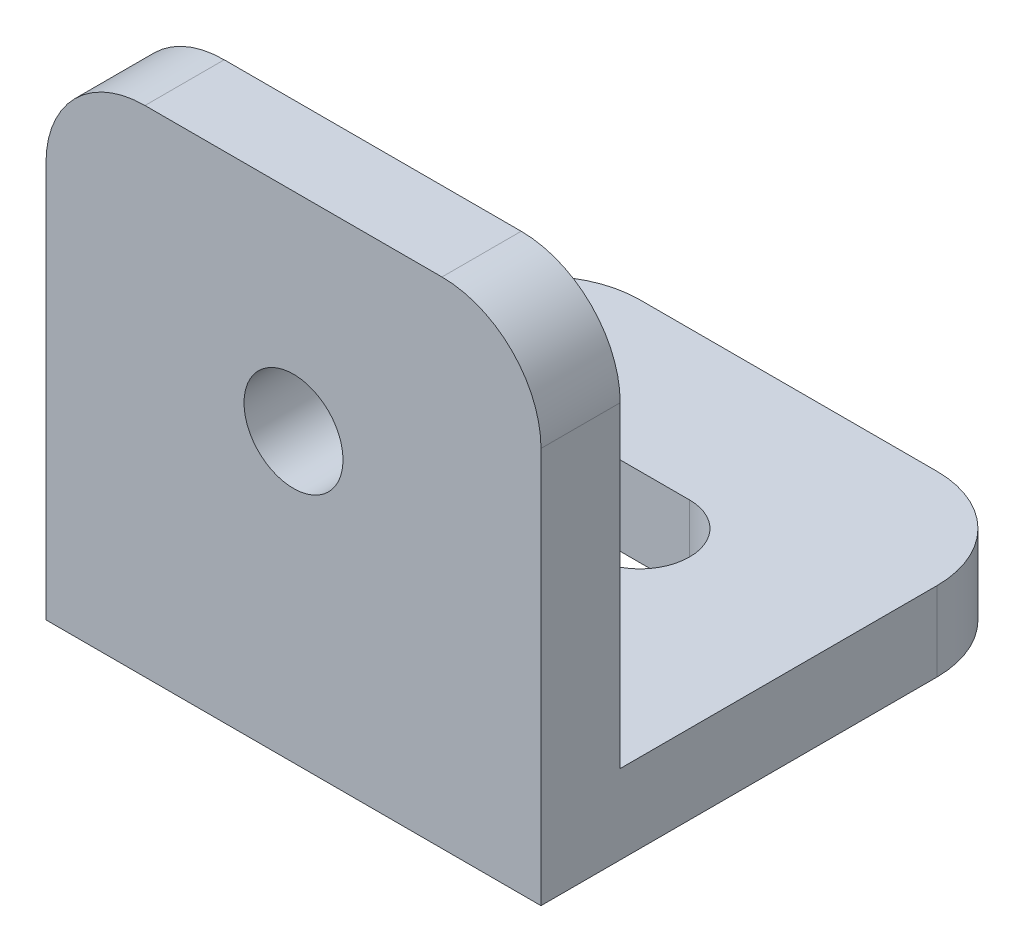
SolidWorks part; units mm, degrees
ref_plane "Front Plane" through (0, 0, 0) normal (0, 0, 1) x (1, 0, 0)
ref_plane "Top Plane" through (0, 0, 0) normal (0, 1, 0) x (1, 0, 0)
ref_plane "Right Plane" through (0, 0, 0) normal (1, 0, 0) x (0, 0, -1)
sketch "Sketch2" plane through (0, 0, 0) normal (1, 0, 0) x (0, 0, -1)
  line L0 (0, 0) -> (50, 0)
  line L2 (0, 50) -> (0, 0)
  dimension "D1" = 50
extrude "Extrude-Thin1" add sketch "Sketch2" along normal mid plane 50 thin
hole_wizard "Ø10.0 (19) Diameter Hole1" positions "Sketch3" profile "Sketch4" hole size "Ø10.0" standard "ANSI Metric"
sketch "Sketch3" plane through (0, 0, -8) normal (0, 0, -1) x (-1, 0, 0)
  line L0 (0, 50) -> (0, 8) construction
  line L1 (-25, 50) -> (25, 50) construction
  line L2 (-25, 8) -> (25, 8) construction
  point P8 (0, 29)
sketch "Sketch4" plane through (0, 29, -8) normal (1, 0, 0) x (0, 1, 0)
  line L0 (0, 0) -> (0, 8)
  line L1 (0, 8) -> (5, 8)
  line L2 (5, 8) -> (5, 0)
  line L5 (5, 0) -> (0, 0)
  line L11 (0, -6.35) -> (0, 107.95) construction
  dimension "Thru Hole Dia." = 10
  dimension "Thru Hole Depth" = 8
hole_wizard "Ø10.0 (10) Diameter Slot1" positions "Sketch5" profile "Sketch7" size "Ø10.0" standard "ANSI Metric"
sketch "Sketch5" plane through (0, 8, 0) normal (0, 1, 0) x (1, 0, 0)
  line L0 (-10, 30) -> (10, 30) construction
  line L1 (0, 30) -> (0, 50) construction
  line L2 (25, 50) -> (-25, 50) construction
  point P0 (0, 30)
  dimension "D1" = 20
  dimension "D2" = 20
sketch "Sketch7" plane through (0, 8, -30) normal (1, 0, 0) x (0, 0, 1)
  line L0 (0, 0) -> (0, 8)
  line L1 (0, 8) -> (5, 8)
  line L2 (5, 8) -> (5, 0)
  line L5 (5, 0) -> (0, 0)
  line L11 (0, -6.35) -> (0, 107.95) construction
  dimension "Thru Hole Dia." = 10
  dimension "Thru Hole Depth" = 8
fillet "Fillet1" radius 10 4 edges at (-25, 4, -50) (25, 4, -50) (-25, 50, -4) (25, 50, -4)
